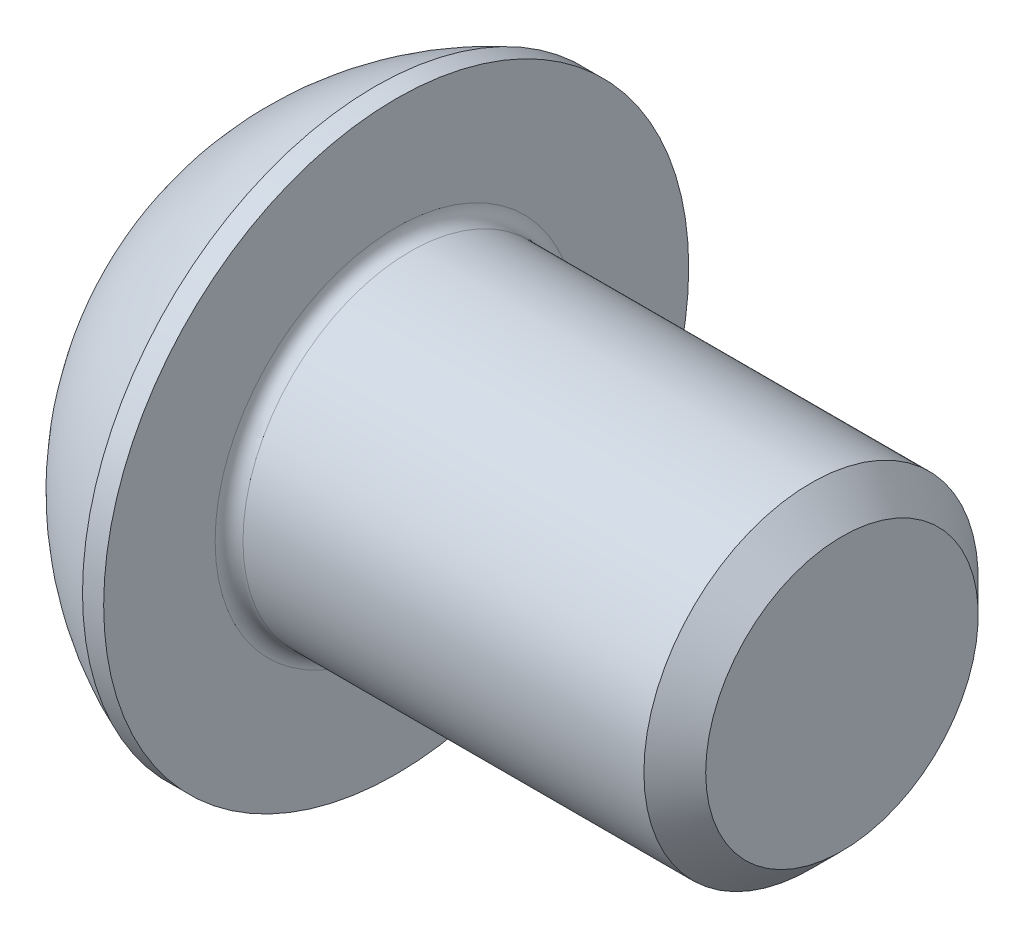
SolidWorks part; units mm, degrees
ref_plane "Plane1" through (0, 0, 0) normal (0, 0, 1) x (1, 0, 0)
ref_plane "Plane2" through (0, 0, 0) normal (0, 1, 0) x (1, 0, 0)
ref_plane "Plane3" through (0, 0, 0) normal (1, 0, 0) x (0, 0, -1)
sketch "BodySke" plane through (0, 0, 0) normal (0, 0, 1) x (1, 0, 0)
  line L0 (11.3, 0) -> (11.3, 2.4455)
  line L1 (10.7455, 3) -> (3.3, 3)
  line L2 (3.3, 3) -> (3.3, 5.25)
  line L3 (3.3, 5.25) -> (2.92, 5.25)
  line L4 (0, 0) -> (101.6, 0) construction
  line L5 (3.3, -5.25) -> (2.92, -5.25) construction
  line L6 (55.6768, -3) -> (3.3, -3) construction
  line L7 (11.3, 0) -> (0, 0)
  line L8 (0, 2.625) -> (0, -2.625) construction
  line L9 (0, 0) -> (0, 2.625)
  line L10 (11.3, 2.4455) -> (10.7455, 3)
  line L11 (11.3, -2.4455) -> (10.7455, -3) construction
  line L12 (4.3, 9.525) -> (4.3, -3) construction
  line L13 (3.3, 9.525) -> (3.3, -3) construction
  arc A1 (0, 2.625) -> (2.92, 5.25) centre (4.9997, 0) cw
  dimension "D1" = 5.25
  dimension "Diameter" = 6
  dimension "Length" = 8
  dimension "Head_dia" = 10.5
  dimension "Head_ht" = 3.3
  dimension "Head_side_ht" = 0.38
  dimension "Minor_dia" = 4.891
  dimension "Body_ch_ang" = 45
  dimension "Advance" = 1
  dimension "Thread_nom" = 8
revolve "BaseBody" add sketch "BodySke" angle 360 about L4
fillet "Fillet1" radius 0.25
sketch "Sketch2" plane through (0, 0, 0) normal (0, 0, 1) x (1, 0, 0)
  line L0 (0, 2) -> (2.08, 2)
  line L1 (2.08, 2) -> (3.2347, 0)
  line L3 (3.2347, 0) -> (0, 0)
  line L4 (0, 0) -> (0, 2)
  line L5 (0, -2) -> (2.08, -2) construction
  line L6 (0, 0) -> (47.625, 0) construction
  dimension "D2" = 60
  dimension "PreBroach_depth" = 2.08
  dimension "PreBroach_dia" = 4
revolve "PreBroach" cut sketch "Sketch2" angle 360 about L6
sketch "Sketch3" plane through (0, 0, 0) normal (1, 0, 0) x (0, 0, -1)
  line L0 (-2, -1.1547) -> (-2, 1.1547)
  line L1 (-2, 1.1547) -> (0, 2.3094)
  line L2 (0, 2.3094) -> (2, 1.1547)
  line L3 (2, 1.1547) -> (2, -1.1547)
  line L4 (2, -1.1547) -> (0, -2.3094)
  line L5 (0, -2.3094) -> (-2, -1.1547)
  dimension "D1" = 2
  dimension "D2" = 2
  dimension "D3" = 4
  dimension "Hex_size" = 4
extrude "Hex" cut sketch "Sketch3" along normal blind 2.08
sketch "ThdSchSke" plane through (0, 0, 0) normal (0, 0, 1) x (1, 0, 0)
  line L0 (5.3, -2.4455) -> (4.9117, -3)
  line L1 (5.3, -2.4455) -> (5.6883, -3)
  line L2 (5.6883, -3) -> (5.6883, -3.75)
  line L3 (-3.175, 0) -> (5.1513, 0) construction
  line L4 (0, 1.1547) -> (0, 2.3094) construction
  line L5 (5.6883, -3.75) -> (4.9117, -3.75)
  line L6 (4.9117, -3.75) -> (4.9117, -3)
  dimension "Thread_minor" = 4.891
  dimension "Diameter" = 6
  dimension "Start" = 5.3
  dimension "SideAngle" = 55
  dimension "VeeAngle" = 70
  dimension "Overcut" = 7.5
revolve "ThreadSchematic" [suppressed] cut sketch "ThdSchSke" angle 360 about L3
pattern_linear "ThdSchPat" [suppressed]
equation "\"D1@BodySke\" = \"Head_dia@BodySke\" * .5"
equation "\"Thread_minor@ThreadCosmetic\" = \"Minor_dia@BodySke\""
equation "\"D1@Sketch3\" = \"Hex_size@Sketch3\" / 2"
equation "\"D2@Sketch3\" = \"D1@Sketch3\""
equation "\"D3@Sketch3\" = \"Hex_size@Sketch3\""
equation "\"Thread_length@ThreadCosmetic\" = ((sgn( (\"Length@BodySke\" - \"Advance@BodySke\" * 2.0) - \"Thread_nom@BodySke\" )-1)*( (\"Length@BodySke\" - \"Advance@BodySke\" * 2.0) - \"Thread_nom@BodySke\" ))/-2+ \"Thread_no"
equation "\"Thread_minor@ThdSchSke\" = \"Minor_dia@BodySke\""
equation "\"Diameter@ThdSchSke\" = \"Diameter@BodySke\""
equation "\"Overcut@ThdSchSke\" = \"Diameter@BodySke\" * 1.25"
equation "\"Start@ThdSchSke\" = \"Head_ht@BodySke\" + \"Length@BodySke\" - \"Thread_length@ThreadCosmetic\"  '---Non-countersunk---"
equation "\"Num_threads@ThdSchPat\" = int( \"Thread_length@ThreadCosmetic\" / \"Advance@BodySke\" + 0.999 )  + 1"
equation "\"Advance@ThdSchPat\" = \"Thread_length@ThreadCosmetic\" /  (\"Num_threads@ThdSchPat\" - 1) 'relax it"
equation "\"Num_threads@ThdSchPat\" = \"Num_threads@ThdSchPat\" - sgn( \"Num_threads@ThdSchPat\" - 1) '---chamfered tips only---"
